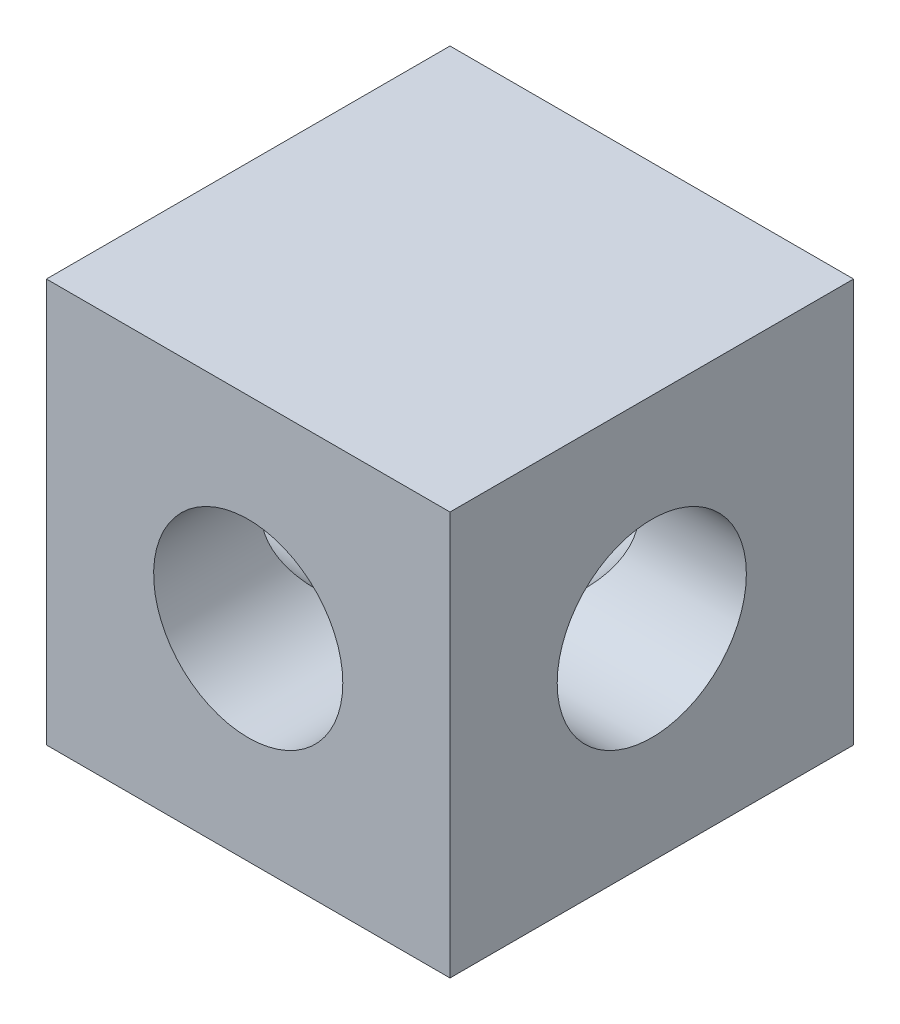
SolidWorks part; units mm, degrees
extrude "Base-Extrude" add sketch "Sketch1" along normal mid plane 20.32
sketch "Sketch1" plane through (0, 0, 0) normal (0, 0, 1) x (1, 0, 0)
  line L0 (-10.16, -10.16) -> (10.16, -10.16)
  line L1 (-10.16, -10.16) -> (-10.16, 10.16)
  line L2 (10.16, 10.16) -> (-10.16, 10.16)
  line L3 (10.16, 10.16) -> (10.16, -10.16)
  line L4 (10.16, 10.16) -> (-10.16, -10.16) construction
  circle A0 centre (0, 0) radius 4.7625
  dimension "R" = 9.525
  dimension "D1" = 20.32
  dimension "D2" = 20.32
extrude "Cut-Extrude1" cut sketch "Sketch3" against normal through all
sketch "Sketch3" plane through (10.16, 0, 0) normal (1, 0, 0) x (0, 0, -1)
  circle A0 centre (0, 0) radius 4.7625
ref_plane "Front" through (0, 0, 0) normal (0, 0, 1) x (1, 0, 0)
ref_plane "Top" through (0, 0, 0) normal (0, 1, 0) x (-1, 0, 0)
ref_plane "Right" through (0, 0, 0) normal (1, 0, 0) x (0, 0, -1)
